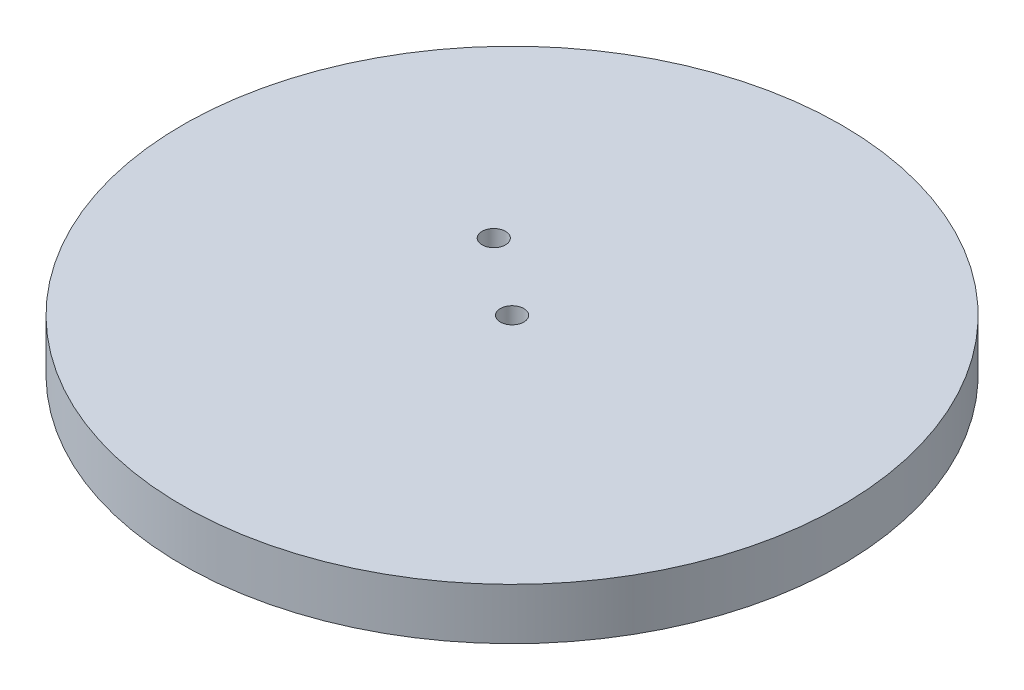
SolidWorks part; units mm, degrees
ref_plane "Ebene vorne" through (0, 0, 0) normal (0, 0, 1) x (1, 0, 0)
ref_plane "Ebene oben" through (0, 0, 0) normal (0, 1, 0) x (1, 0, 0)
ref_plane "Ebene rechts" through (0, 0, 0) normal (1, 0, 0) x (0, 0, -1)
sketch "Skizze1" plane through (0, 0, 0) normal (1, 0, 0) x (0, 0, -1)
  line L0 (0, 0) -> (0, -14.2805) construction
  line L1 (1.6, 7) -> (1.6, 0)
  line L3 (11, 0) -> (25.1, 0)
  line L4 (0, 0) -> (0, 10.4672) construction
  line L5 (25.1, -3.5333) -> (34.9, -3.5333)
  line L6 (34.9, -3.5333) -> (34.9, 0)
  line L7 (34.9, 0) -> (44.9, 0)
  line L8 (44.9, 0) -> (44.9, 7)
  line L9 (44.9, 7) -> (1.6, 7)
  line L10 (25.1, 0) -> (25.1, -3.5333)
  line L11 (1.6, 0) -> (1.6, -26.5385) construction
  line L12 (1.6, 0) -> (1.6, -10.883)
  arc A0 (11, 0) -> (1.6, -10.883) centre (0, 0) cw
revolve "Rotation1" add sketch "Skizze1" angle 360 about L4
sketch "Skizze2" plane through (0, 0, 0) normal (0, -1, 0) x (-1, 0, 0)
  circle A0 centre (10.3528, 7.8625) radius 1.6
  circle A1 centre (0, 0) radius 11 construction
extrude "Schnitt-Linear austragen1" cut sketch "Skizze2" against normal blind 10
fillet "Verrundung1" radius 2 1 edges at (0, -10.883, -1.6)
